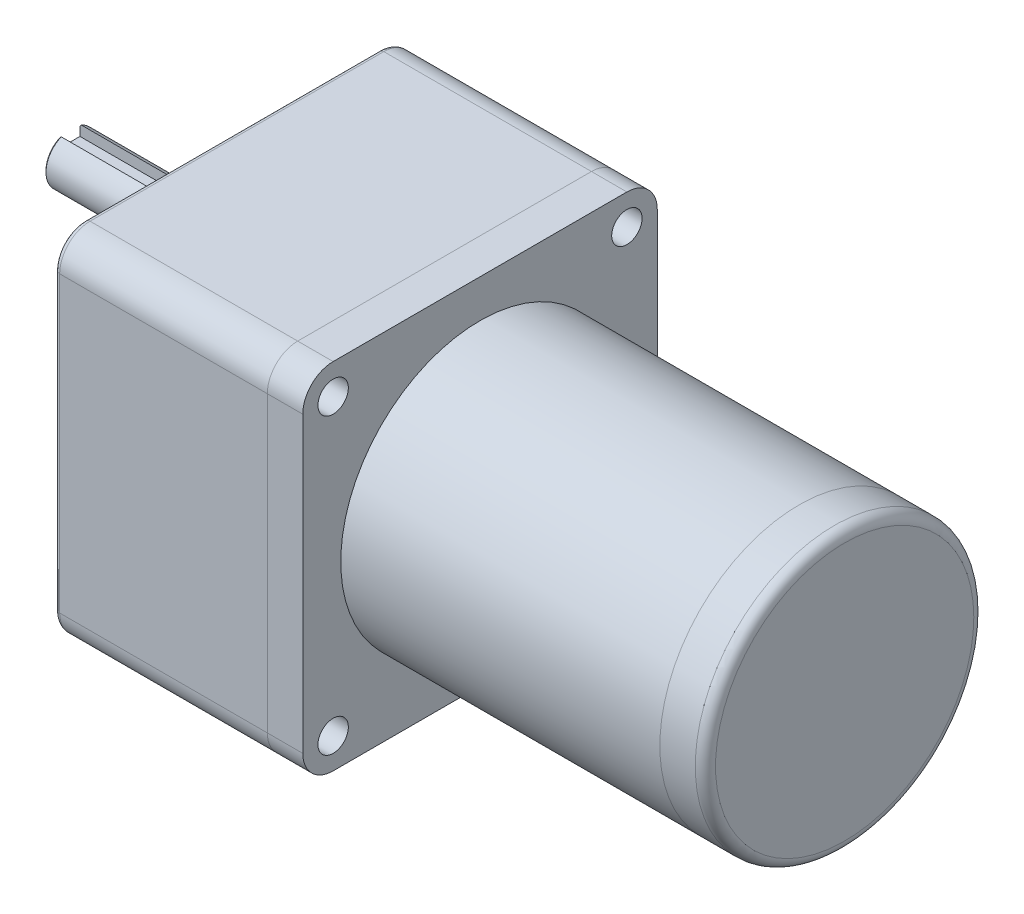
SolidWorks part; units mm, degrees
ref_plane "前视基准面" through (0, 0, 0) normal (0, 0, 1) x (1, 0, 0)
ref_plane "上视基准面" through (0, 0, 0) normal (0, 1, 0) x (1, 0, 0)
ref_plane "右视基准面" through (0, 0, 0) normal (1, 0, 0) x (0, 0, -1)
sketch "草图1" plane through (0, 0, 0) normal (1, 0, 0) x (0, 0, -1)
  line L1 (29, -35) -> (-29, -35)
  line L2 (35, -29) -> (35, 29)
  line L3 (29, 35) -> (-29, 35)
  line L4 (-35, -29) -> (-35, 29)
  line L5 (35, -35) -> (-35, 35) construction
  line L6 (35, 35) -> (-35, -35) construction
  arc A0 (-29, -35) -> (-35, -29) centre (-29, -29) cw
  arc A1 (29, -35) -> (35, -29) centre (29, -29) ccw
  arc A2 (35, 29) -> (29, 35) centre (29, 29) ccw
  arc A3 (-29, 35) -> (-35, 29) centre (-29, 29) ccw
  point P0 (0, 0)
  dimension "D1" = 6
extrude "凸台-拉伸1" add sketch "草图1" along normal blind 42
sketch "草图2" plane through (42, 0, 0) normal (1, 0, 0) x (0, 0, -1)
  line L0 (29, 35) -> (-29, 35) construction
  line L1 (-29, -35) -> (29, -35)
  line L2 (-35, -29) -> (-35, 29)
  line L3 (-29, 35) -> (29, 35)
  line L4 (35, -29) -> (35, 29)
  line L5 (-35, -35) -> (35, 35) construction
  line L6 (-35, 35) -> (35, -35) construction
  arc A0 (29, 35) -> (35, 29) centre (29, 29) cw
  arc A1 (29, -35) -> (35, -29) centre (29, -29) ccw
  arc A2 (-29, -35) -> (-35, -29) centre (-29, -29) cw
  arc A3 (-35, 29) -> (-29, 35) centre (-29, 29) cw
  point P0 (0, 0)
  dimension "D1" = 6
extrude "凸台-拉伸2" add sketch "草图2" along normal blind 7 separate body
fillet "圆角1" radius 1 8 edges at (0, -35, 0) (0, -33.2426, -33.2426) (0, 0, -35) (0, 33.2426, -33.2426) (0, 35, 0) (0, 33.2426, 33.2426) (0, 0, 35) (0, -33.2426, 33.2426)
sketch "草图3" plane through (49, 0, 0) normal (1, 0, 0) x (0, 0, -1)
  circle A0 centre (0, 0) radius 27.5
extrude "凸台-拉伸3" add sketch "草图3" along normal blind 63 separate body
sketch "草图4" plane through (112, 0, 0) normal (1, 0, 0) x (0, 0, -1)
  circle A0 centre (0, 0) radius 27.5
extrude "凸台-拉伸4" add sketch "草图4" along normal blind 9 separate body
fillet "圆角2" radius 2 1 edges at (121, 0, -27.5)
sketch "草图5" plane through (0, 0, 0) normal (-1, 0, 0) x (0, 0, 1)
  point P19 (-28.9914, 28.9914)
  point P20 (28.9914, 28.9914)
  point P21 (28.9914, -28.9914)
  point P22 (-28.9914, -28.9914)
hole_wizard "M5 螺纹孔1" positions "3D草图1" profile "草图6" tap size "M5" standard "GB"
sketch3d "3D草图1"
  point P0 (0, 28.9914, -28.9914)
  point P3 (0, -28.9914, -28.9914)
  point P6 (0, -28.9914, 28.9914)
  point P9 (0, 28.9914, 28.9914)
sketch "草图6" plane through (0, 28.9914, -28.9914) normal (0, 1, 0) x (0, 0, 1)
  line L0 (0, 0) -> (0, 15.2618)
  line L1 (0, 15.2618) -> (2.1, 14)
  line L2 (2.1, 14) -> (2.1, 0)
  line L5 (2.1, 0) -> (0, 0)
  line L10 (0, 15.2618) -> (-2.1, 14) construction
  line L11 (0, -6.35) -> (0, 107.95) construction
  dimension "螺纹孔钻头直径" = 4.2
  dimension "螺纹孔钻头深度" = 14
  dimension "导头角度" = 118
sketch "草图7" plane through (49, 0, 0) normal (1, 0, 0) x (0, 0, -1)
  circle A1 centre (-29, 29) radius 3
  circle A2 centre (29, 29) radius 3
  circle A3 centre (29, -29) radius 3
  circle A4 centre (-29, -29) radius 3
extrude "切除-拉伸1" cut sketch "草图7" against normal blind 35
sketch "草图8" plane through (0, 0, 0) normal (-1, 0, 0) x (0, 0, 1)
  circle A0 centre (0, 15) radius 12
extrude "凸台-拉伸5" add sketch "草图8" along normal blind 3 separate body
sketch "草图9" plane through (-3, 0, 0) normal (-1, 0, 0) x (0, 0, 1)
  circle A0 centre (0, 15) radius 5
extrude "凸台-拉伸6" add sketch "草图9" along normal blind 29 separate body
fillet "圆角3" radius 0.5 1 edges at (-3, 15, 12)
sketch "草图10" plane through (0, 0, 0) normal (-1, 0, 0) x (0, 0, 1)
  circle A0 centre (0, 0) radius 30
extrude "切除-拉伸2" cut sketch "草图10" against normal blind 0.5
ref_plane "基准面1" through (0, 20, 0) normal (0, 1, 0) x (1, 0, 0)
sketch "草图11" plane through (0, 20, 0) normal (0, 1, 0) x (1, 0, 0)
  line L1 (-32, 5) -> (-32, -5) construction
  line L2 (-9, 2) -> (-32, 2)
  line L3 (-32, 2) -> (-32, -2)
  line L4 (-32, -2) -> (-9, -2)
  arc A0 (-9, -2) -> (-9, 2) centre (-9, 0) ccw
extrude "切除-拉伸3" cut sketch "草图11" against normal blind 2.5
chamfer "倒角1" distance 0.3 angle 45 1 edges at (-32, 10, 0)
